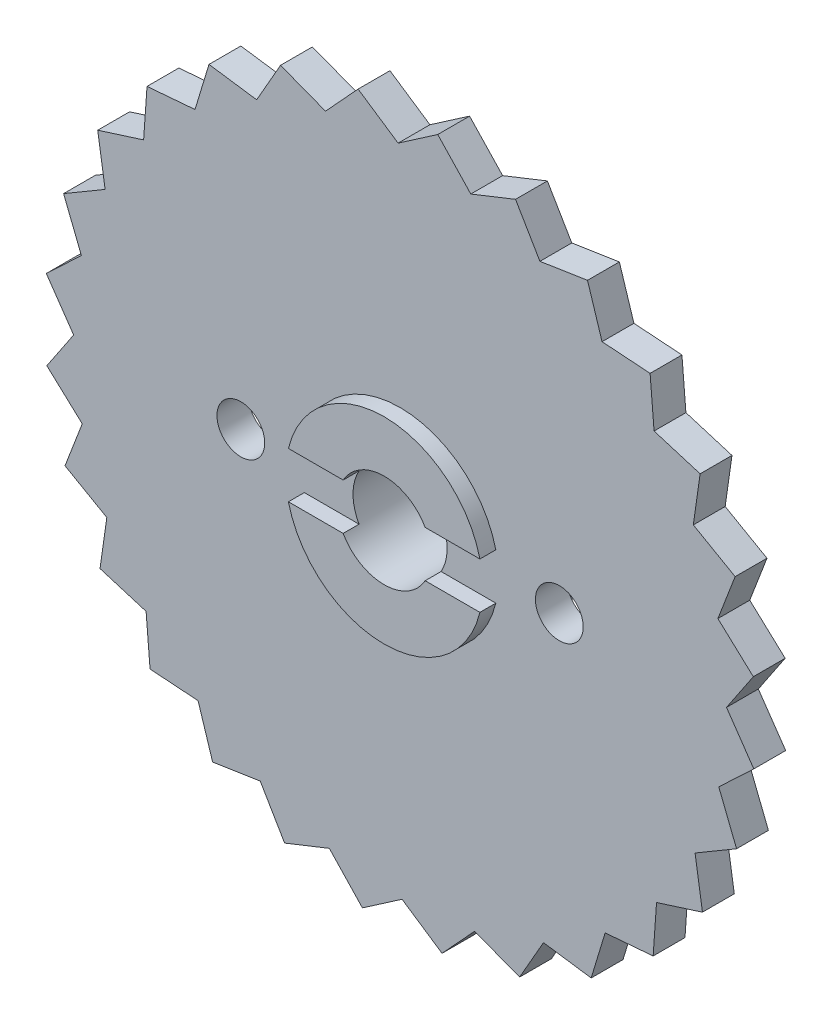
SolidWorks part; units mm, degrees
ref_plane "Plan de face" through (0, 0, 0) normal (0, 0, 1) x (1, 0, 0)
ref_plane "Plan de dessus" through (0, 0, 0) normal (0, 1, 0) x (1, 0, 0)
ref_plane "Plan de droite" through (0, 0, 0) normal (1, 0, 0) x (0, 0, -1)
sketch "Esquisse1" plane through (0, 0, 0) normal (0, 0, 1) x (1, 0, 0)
  circle A0 centre (0, 0) radius 22.34
  dimension "D1" = 44.68
extrude "Extrusion1" add sketch "Esquisse1" along normal blind 9
sketch "Esquisse2" plane through (0, 0, 9) normal (0, 0, 1) x (1, 0, 0)
  circle A0 centre (0, 0) radius 6.185
  circle A1 centre (0, 0) radius 22.34
  dimension "D1" = 12.37
  dimension "D2" = 44.68
extrude "Enlèv. mat.-Extru.1" cut sketch "Esquisse2" against normal blind 1
sketch "Esquisse3" plane through (0, 0, 9) normal (0, 0, 1) x (1, 0, 0)
  circle A0 centre (0, 0) radius 2.955
  dimension "D1" = 5.91
extrude "Enlèv. mat.-Extru.2" cut sketch "Esquisse3" against normal through all
sketch "Esquisse4" plane through (0, 0, 0) normal (0, 0, -1) x (-1, 0, 0)
  circle A0 centre (0, 0) radius 8.5
  circle A1 centre (0, 0) radius 22.34
  dimension "D1" = 17
  dimension "D2" = 44.68
extrude "Enlèv. mat.-Extru.3" cut sketch "Esquisse4" against normal blind 6
sketch "Esquisse5" plane through (0, 0, 0) normal (0, 0, -1) x (-1, 0, 0)
  circle A0 centre (0, 0) radius 6.975
  circle A2 centre (0, 0) radius 8.5
  dimension "D1" = 17
  dimension "D2" = 13.95
extrude "Enlèv. mat.-Extru.4" cut sketch "Esquisse5" against normal blind 1
sketch "Esquisse6" plane through (0, 0, 1) normal (0, 0, -1) x (-1, 0, 0)
  circle A0 centre (0, 0) radius 5.97
  circle A1 centre (0, 0) radius 8.5
  dimension "D1" = 11.94
  dimension "D2" = 17
extrude "Enlèv. mat.-Extru.5" cut sketch "Esquisse6" against normal blind 3.22
sketch "Esquisse7" plane through (0, 0, 4.22) normal (0, 0, -1) x (-1, 0, 0)
  circle A0 centre (0, 0) radius 6.96
  circle A1 centre (0, 0) radius 8.5
  dimension "D1" = 13.92
  dimension "D2" = 17
extrude "Enlèv. mat.-Extru.6" cut sketch "Esquisse7" against normal blind 1.78
sketch "Esquisse9" plane through (0, 0, 8) normal (0, 0, 1) x (1, 0, 0)
  line L0 (-22.184, -2.6357) -> (0, 0) construction
  line L1 (0, 0) -> (-22.2143, 2.3668) construction
  line L2 (0, 0) -> (-22.3396, -0.1353)
  line L3 (-19.3801, -2.3026) -> (-19.3933, -0.1175) construction
  line L4 (-19.3933, -0.1175) -> (-19.4065, 2.0676) construction
  line L5 (-22.184, -2.6357) -> (-20.4996, -0.1242)
  line L6 (-20.4996, -0.1242) -> (-22.2143, 2.3668)
  line L7 (-22.184, -2.6357) -> (-19.958, -4.6827)
  line L8 (-19.958, -4.6827) -> (-21.0413, -7.506)
  line L9 (0, 0) -> (-21.0413, -7.506) construction
  line L10 (-15.9498, -12.8784) -> (-15.7008, -15.8922)
  line L11 (-18.8435, -12) -> (-15.9498, -12.8784)
  line L12 (-18.8435, -12) -> (-18.4156, -9.0063)
  line L13 (-18.4156, -9.0063) -> (-21.0413, -7.506)
  line L14 (0, 0) -> (-15.7008, -15.8922) construction
  line L15 (-12.6842, -16.1047) -> (-15.7008, -15.8922)
  line L16 (-11.7708, -18.9875) -> (-12.6842, -16.1047)
  line L17 (-11.7708, -18.9875) -> (-8.7826, -18.5234)
  line L18 (-8.7826, -18.5234) -> (-7.2506, -21.1307)
  line L19 (-4.4405, -20.0133) -> (-7.2506, -21.1307)
  line L20 (-2.3668, -22.2143) -> (-4.4405, -20.0133)
  line L21 (-2.3668, -22.2143) -> (0.1242, -20.4996)
  line L22 (0.1242, -20.4996) -> (2.6357, -22.184)
  line L23 (0, 0) -> (2.6357, -22.184) construction
  line L24 (4.6827, -19.958) -> (2.6357, -22.184)
  line L25 (7.506, -21.0413) -> (4.6827, -19.958)
  line L26 (7.506, -21.0413) -> (9.0063, -18.4156)
  line L27 (9.0063, -18.4156) -> (12, -18.8435)
  line L28 (12.8784, -15.9498) -> (12, -18.8435)
  line L29 (15.8922, -15.7008) -> (12.8784, -15.9498)
  line L30 (15.8922, -15.7008) -> (16.1047, -12.6842)
  line L31 (16.1047, -12.6842) -> (18.9875, -11.7708)
  line L32 (18.5234, -8.7826) -> (18.9875, -11.7708)
  line L33 (21.1307, -7.2506) -> (18.5234, -8.7826)
  line L34 (21.1307, -7.2506) -> (20.0133, -4.4405)
  line L35 (20.0133, -4.4405) -> (22.2143, -2.3668)
  line L36 (20.4996, 0.1242) -> (22.2143, -2.3668)
  line L37 (22.184, 2.6357) -> (20.4996, 0.1242)
  line L38 (22.184, 2.6357) -> (19.958, 4.6827)
  line L39 (19.958, 4.6827) -> (21.0413, 7.506)
  line L40 (-7.506, 21.0413) -> (-9.0063, 18.4156)
  line L41 (-9.0063, 18.4156) -> (-12, 18.8435)
  line L42 (-12.8784, 15.9498) -> (-12, 18.8435)
  line L43 (-15.8922, 15.7008) -> (-12.8784, 15.9498)
  line L44 (-15.8922, 15.7008) -> (-16.1047, 12.6842)
  line L45 (-16.1047, 12.6842) -> (-18.9875, 11.7708)
  line L46 (-18.5234, 8.7826) -> (-18.9875, 11.7708)
  line L47 (-21.1307, 7.2506) -> (-18.5234, 8.7826)
  line L48 (-21.1307, 7.2506) -> (-20.0133, 4.4405)
  line L49 (-20.0133, 4.4405) -> (-22.2143, 2.3668)
  line L50 (21.0413, 7.506) -> (0, 0) construction
  line L51 (-7.506, 21.0413) -> (-4.6827, 19.958)
  line L52 (-4.6827, 19.958) -> (-2.6357, 22.184)
  line L53 (-0.1242, 20.4996) -> (-2.6357, 22.184)
  line L54 (2.3668, 22.2143) -> (-0.1242, 20.4996)
  line L55 (2.3668, 22.2143) -> (4.4405, 20.0133)
  line L56 (4.4405, 20.0133) -> (7.2506, 21.1307)
  line L57 (8.7826, 18.5234) -> (7.2506, 21.1307)
  line L58 (11.7708, 18.9875) -> (8.7826, 18.5234)
  line L59 (11.7708, 18.9875) -> (12.6842, 16.1047)
  line L60 (12.6842, 16.1047) -> (15.7008, 15.8922)
  line L61 (15.9498, 12.8784) -> (15.7008, 15.8922)
  line L62 (18.8435, 12) -> (15.9498, 12.8784)
  line L63 (18.8435, 12) -> (18.4156, 9.0063)
  line L64 (18.4156, 9.0063) -> (21.0413, 7.506)
  circle A0 centre (0, 0) radius 22.34
  circle A1 centre (0, 0) radius 20.5
  arc A2 (-22.2143, 2.3668) -> (-22.184, -2.6357) centre (-20.4996, -0.1242) ccw
  arc A3 (-21.0413, -7.506) -> (-22.184, -2.6357) centre (-19.958, -4.6827) cw
  arc A4 (-15.7008, -15.8922) -> (-18.8435, -12) centre (-15.9498, -12.8784) cw
  arc A5 (-21.0413, -7.506) -> (-18.8435, -12) centre (-18.4156, -9.0063) ccw
  arc A6 (-15.7008, -15.8922) -> (-11.7708, -18.9875) centre (-12.6842, -16.1047) ccw
  arc A7 (-7.2506, -21.1307) -> (-11.7708, -18.9875) centre (-8.7826, -18.5234) cw
  arc A8 (-7.2506, -21.1307) -> (-2.3668, -22.2143) centre (-4.4405, -20.0133) ccw
  arc A9 (2.6357, -22.184) -> (-2.3668, -22.2143) centre (0.1242, -20.4996) cw
  arc A10 (2.6357, -22.184) -> (7.506, -21.0413) centre (4.6827, -19.958) ccw
  arc A11 (12, -18.8435) -> (7.506, -21.0413) centre (9.0063, -18.4156) cw
  arc A12 (12, -18.8435) -> (15.8922, -15.7008) centre (12.8784, -15.9498) ccw
  arc A13 (18.9875, -11.7708) -> (15.8922, -15.7008) centre (16.1047, -12.6842) cw
  arc A14 (18.9875, -11.7708) -> (21.1307, -7.2506) centre (18.5234, -8.7826) ccw
  arc A15 (22.2143, -2.3668) -> (21.1307, -7.2506) centre (20.0133, -4.4405) cw
  arc A16 (22.2143, -2.3668) -> (22.184, 2.6357) centre (20.4996, 0.1242) ccw
  arc A17 (21.0413, 7.506) -> (22.184, 2.6357) centre (19.958, 4.6827) cw
  arc A18 (-12, 18.8435) -> (-7.506, 21.0413) centre (-9.0063, 18.4156) cw
  arc A19 (-12, 18.8435) -> (-15.8922, 15.7008) centre (-12.8784, 15.9498) ccw
  arc A20 (-18.9875, 11.7708) -> (-15.8922, 15.7008) centre (-16.1047, 12.6842) cw
  arc A21 (-18.9875, 11.7708) -> (-21.1307, 7.2506) centre (-18.5234, 8.7826) ccw
  arc A22 (-22.2143, 2.3668) -> (-21.1307, 7.2506) centre (-20.0133, 4.4405) cw
  arc A23 (-2.6357, 22.184) -> (-7.506, 21.0413) centre (-4.6827, 19.958) ccw
  arc A24 (-2.6357, 22.184) -> (2.3668, 22.2143) centre (-0.1242, 20.4996) cw
  arc A25 (7.2506, 21.1307) -> (2.3668, 22.2143) centre (4.4405, 20.0133) ccw
  arc A26 (7.2506, 21.1307) -> (11.7708, 18.9875) centre (8.7826, 18.5234) cw
  arc A27 (15.7008, 15.8922) -> (11.7708, 18.9875) centre (12.6842, 16.1047) ccw
  arc A28 (15.7008, 15.8922) -> (18.8435, 12) centre (15.9498, 12.8784) cw
  arc A29 (21.0413, 7.506) -> (18.8435, 12) centre (18.4156, 9.0063) ccw
  point P9 (-20.4996, -0.1242)
  dimension "D1" = 44.68
  dimension "D2" = 41
  dimension "D3" = 12.857
  dimension "D4" = 1.84
extrude "Enlèv. mat.-Extru.7" cut sketch "Esquisse9" against normal through all
sketch "Esquisse13" plane through (0, 0, 9) normal (0, 0, 1) x (1, 0, 0)
  line L0 (-6.185, 0) -> (6.185, 0) construction
  line L1 (6.185, 0) -> (6.185, 1.45)
  line L2 (6.185, 0) -> (6.185, -1.45)
  line L3 (-6.185, 0) -> (-6.185, 1.45)
  line L4 (-6.185, -1.45) -> (6.185, -1.45)
  line L5 (-6.185, 1.45) -> (6.185, 1.45)
  line L7 (-6.185, 0) -> (-6.185, -1.45)
  circle A0 centre (0, 0) radius 6.185 construction
  dimension "D1" = 1.45
  dimension "D2" = 1.45
extrude "Enlèv. mat.-Extru.14" cut sketch "Esquisse13" against normal blind 1
sketch "Esquisse14" plane through (0, 0, 0) normal (0, 0, -1) x (-1, 0, 0)
  line L0 (-6.975, 0) -> (6.975, 0) construction
  line L1 (6.975, 0) -> (6.975, 1.45)
  line L2 (6.975, 0) -> (6.975, -1.45)
  line L3 (6.975, 1.45) -> (-6.975, 1.45)
  line L4 (-6.975, 1.45) -> (-6.975, -1.45)
  line L5 (-6.975, -1.45) -> (6.975, -1.45)
  circle A0 centre (0, 0) radius 6.975 construction
  dimension "D1" = 1.45
  dimension "D2" = 1.45
extrude "Enlèv. mat.-Extru.15" cut sketch "Esquisse14" against normal blind 0.5
sketch "Esquisse15" plane through (0, 0, 0) normal (1, 0, 0) x (0, 0, -1)
  line L0 (-2.61, 5.97) -> (-2.61, -5.97) construction
  line L1 (-4.22, 5.97) -> (-1, 5.97)
  line L2 (-4.22, 5.97) -> (-4.22, -5.97)
  line L3 (-4.22, -5.97) -> (-1, -5.97)
  line L4 (-1, 5.97) -> (-1, -5.97)
  line L5 (-4.22, 0) -> (-1, 0) construction
  line L6 (-2.61, 1.5) -> (-2.61, -1.5)
  line L7 (-4.11, 0) -> (-1.11, 0)
  circle A0 centre (-2.61, 0) radius 1.5
  dimension "D1" = 3
extrude "Enlèv. mat.-Extru.16" cut sketch "Esquisse15" against normal through all and the other way through all
sketch "Esquisse16" plane through (0, 0, 8) normal (0, 0, 1) x (1, 0, 0)
  line L0 (-18.7041, 0) -> (17.2521, 0) construction
  line L1 (0, 16.1419) -> (0, -18.1916) construction
  circle A0 centre (-10, 0) radius 1.5
  circle A1 centre (10, 0) radius 1.5
  dimension "D1" = 3
  dimension "D2" = 10
extrude "Enlèv. mat.-Extru.17" cut sketch "Esquisse16" against normal blind 10
